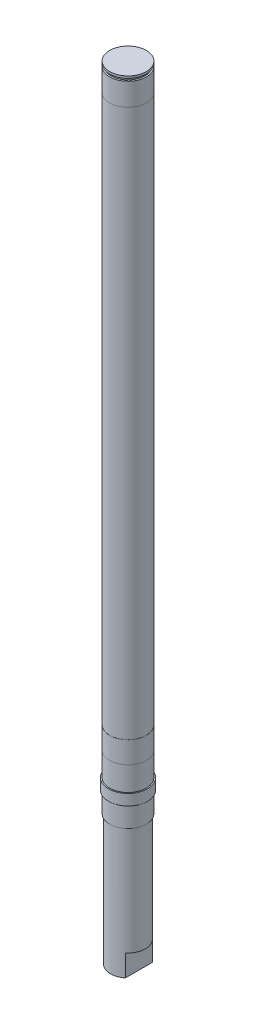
SolidWorks part; units mm, degrees
ref_plane "Face" through (0, 0, 0) normal (0, 0, 1) x (1, 0, 0)
ref_plane "Dessus" through (0, 0, 0) normal (0, 1, 0) x (1, 0, 0)
ref_plane "Droite" through (0, 0, 0) normal (1, 0, 0) x (0, 0, -1)
sketch "Esquisse1" plane through (0, 0, 0) normal (0, 0, 1) x (1, 0, 0)
  line L0 (0, 0) -> (0, 360.5) construction
  line L1 (0, 0) -> (8, 0)
  line L2 (8.45, 85.5) -> (8.5, 85.5)
  line L3 (8.5, 95.5) -> (8.45, 95.5)
  line L4 (8.45, 95.5) -> (8.45, 348)
  line L5 (8.45, 60) -> (8.45, 69.4)
  line L6 (8.45, 359.5) -> (7.75, 359.5)
  line L7 (8.45, 360.5) -> (0, 360.5)
  line L8 (0, 0) -> (0, 360.5)
  line L9 (8.5, 85.5) -> (8.5, 95.5)
  line L10 (7.75, 359.5) -> (7.75, 358.4)
  line L11 (8.45, 60) -> (8, 60)
  line L12 (8.45, 359.5) -> (8.45, 360.5)
  line L13 (8.45, 348) -> (8.5, 348)
  line L14 (8.5, 348) -> (8.5, 358.4)
  line L15 (8.5, 358.4) -> (7.75, 358.4)
  line L16 (8, 60) -> (8, 0)
  line L17 (8.45, 74.4) -> (8.45, 85.5)
  line L18 (8.45, 74.4) -> (9, 74.4)
  line L19 (8.45, 69.4) -> (9, 69.4)
  line L20 (9, 74.4) -> (9, 69.4)
  dimension "D1" = 1.1
  dimension "D2" = 5
  dimension "D3" = 252.5
  dimension "D4" = 360.5
  dimension "D5" = 10
  dimension "D6" = 9
  dimension "D7" = 8.45
  dimension "D8" = 1
  dimension "D9" = 7.75
  dimension "D10" = 10.4
  dimension "D11" = 8.5
  dimension "D12" = 11.1
  dimension "D13" = 8
  dimension "D14" = 8.5
  dimension "D16" = 9.4
  dimension "D17" = 60
revolve "Révolution1" add sketch "Esquisse1" angle 360 about L0
sketch "Esquisse2" plane through (0, 0, 0) normal (0, -1, 0) x (1, 0, 0)
  line L1 (5, -12.3054) -> (-5, -12.3054)
  line L2 (5, -12.3054) -> (5, 12.3054)
  line L3 (5, 12.3054) -> (-5, 12.3054)
  line L4 (-5, -12.3054) -> (-5, 12.3054)
  line L5 (5, -12.3054) -> (-5, 12.3054) construction
  line L6 (5, 12.3054) -> (-5, -12.3054) construction
  point P0 (0, 0)
  dimension "D1" = 10
extrude "Extrusion1" cut sketch "Esquisse2" against normal blind 10 flip side to cut
